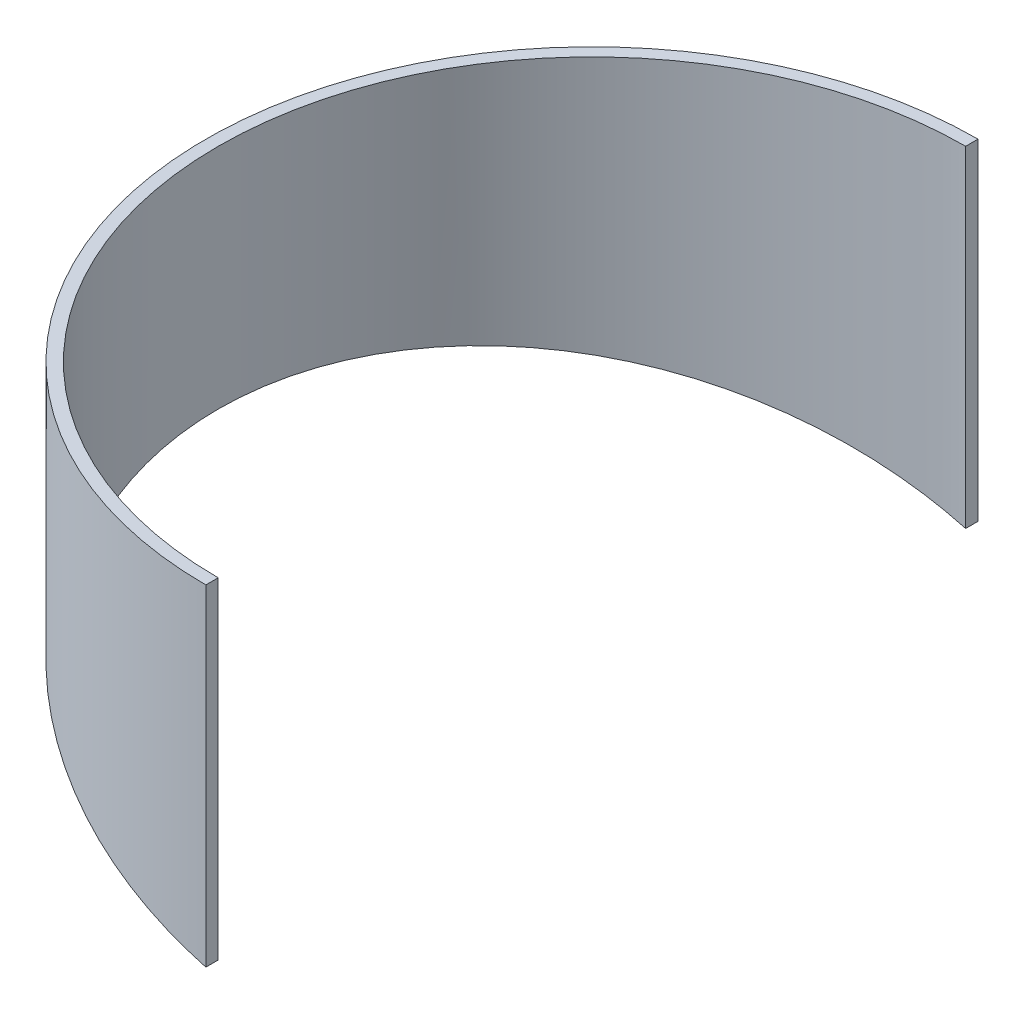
SolidWorks part; units mm, degrees
ref_plane "前视基准面" through (0, 0, 0) normal (0, 0, 1) x (1, 0, 0)
ref_plane "上视基准面" through (0, 0, 0) normal (0, 1, 0) x (1, 0, 0)
ref_plane "右视基准面" through (0, 0, 0) normal (1, 0, 0) x (0, 0, -1)
imported_body "基体零件-人字形三通管-1"
sheet metal parameters "钣金1" parameters "D1"=0.7366, "厚度"=8
bend "圆角折弯1" bend radius 242 bend angle 180 parameters "D5"=1
flatten bends "展开-折弯1"
sketch "尖角-草图1" plane through (0, -107.1797, 250) normal (0, 0, 1) x (1, 0, 0)
  line L0 (-380.1327, -107.1797) -> (-380.1327, 107.1797) construction
  dimension "D1" = 0
process bends "加工-折弯1" parameters "D1"=0
sketch "平面-草图1" plane through (0, -107.1797, 250) normal (0, 0, 1) x (1, 0, 0)
